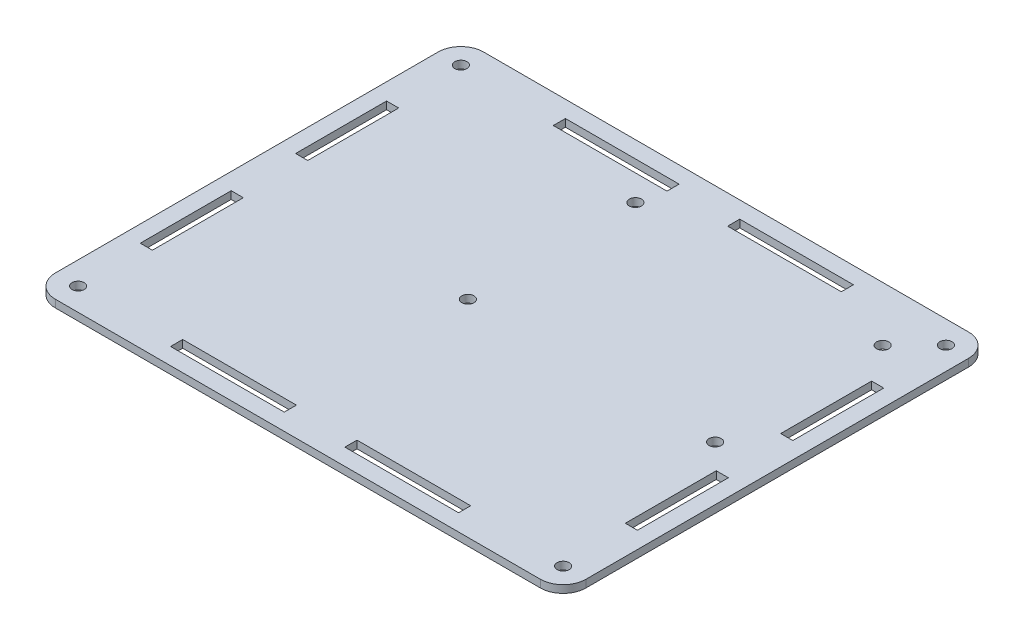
SolidWorks part; units mm, degrees
ref_plane "Front Plane" through (0, 0, 0) normal (0, 0, 1) x (1, 0, 0)
ref_plane "Top Plane" through (0, 0, 0) normal (0, 1, 0) x (1, 0, 0)
ref_plane "Right Plane" through (0, 0, 0) normal (1, 0, 0) x (0, 0, -1)
sketch "Sketch1" plane through (0, 0, 0) normal (0, 1, 0) x (1, 0, 0)
  line L0 (0, 0) -> (0, 50000) construction
  line L1 (0, 0) -> (140, 0)
  line L2 (0, 0) -> (0, 113)
  line L3 (0, 113) -> (140, 113)
  line L4 (140, 0) -> (140, 113)
  line L9 (140, 0) -> (140, 50000) construction
  line L10 (128, 0) -> (128, 50000) construction
  line L11 (66.2458, -26.4225) -> (66.2458, 49973.5775) construction
  line L12 (52.3371, 157.6359) -> (52.3371, -49842.3641) construction
  line L13 (12, -41.4903) -> (12, 49958.5097) construction
  line L14 (-38.7648, 12) -> (49961.2352, 12) construction
  line L15 (-49.8918, 101) -> (49950.1082, 101) construction
  line L16 (135.6, 24) -> (132.4, 24)
  line L17 (-84.1999, 52) -> (49915.8001, 52) construction
  line L18 (70, 148.2273) -> (70, -49851.7727) construction
  line L19 (32, 7.6) -> (62, 7.6)
  line L20 (32, 108.6) -> (62, 108.6)
  line L21 (32, 108.6) -> (32, 105.4)
  line L22 (32, 105.4) -> (62, 105.4)
  line L23 (62, 108.6) -> (62, 105.4)
  line L28 (32, 7.6) -> (32, 4.4)
  line L29 (32, 4.4) -> (62, 4.4)
  line L30 (62, 7.6) -> (62, 4.4)
  line L35 (108, 7.6) -> (108, 4.4)
  line L40 (4.4, 89) -> (7.6, 89)
  line L41 (4.4, 89) -> (4.4, 65)
  line L42 (4.4, 65) -> (7.6, 65)
  line L43 (7.6, 89) -> (7.6, 65)
  line L44 (4.4, 48) -> (7.6, 48)
  line L45 (4.4, 48) -> (4.4, 24)
  line L46 (4.4, 24) -> (7.6, 24)
  line L47 (7.6, 48) -> (7.6, 24)
  line L56 (108, 4.4) -> (78, 4.4)
  line L57 (78, 7.6) -> (78, 4.4)
  line L58 (108, 7.6) -> (78, 7.6)
  line L59 (108, 105.4) -> (78, 105.4)
  line L60 (78, 108.6) -> (78, 105.4)
  line L61 (108, 108.6) -> (78, 108.6)
  line L62 (108, 108.6) -> (108, 105.4)
  line L63 (132.4, 48) -> (132.4, 24)
  line L64 (135.6, 48) -> (132.4, 48)
  line L65 (135.6, 48) -> (135.6, 24)
  line L66 (135.6, 65) -> (132.4, 65)
  line L67 (132.4, 89) -> (132.4, 65)
  line L68 (135.6, 89) -> (132.4, 89)
  line L69 (135.6, 89) -> (135.6, 65)
  line L70 (-70.1779, 42) -> (49929.8221, 42) construction
  circle A1 centre (60.437, 98.62) radius 1.6
  circle A2 centre (125.69, 98.62) radius 1.6
  circle A3 centre (125.69, 54.418) radius 1.6
  circle A4 centre (60.437, 54.418) radius 1.6
  circle A7 centre (6, 107) radius 1.6
  circle A8 centre (134, 107) radius 1.6
  circle A9 centre (134, 6) radius 1.6
  circle A10 centre (6, 6) radius 1.6
  point P75 (0, 0)
  point P76 (0, 0)
  point P77 (0, 0)
  point P78 (32, 107)
  point P79 (0, 0)
  point P88 (32, 6)
  point P95 (6, 89)
  point P96 (6, 65)
  point P97 (6, 48)
  point P98 (6, 24)
  dimension "D14" = 65.253
  dimension "D16" = 8
  dimension "D22" = 30
  dimension "D24" = 44.202
  dimension "D1" = 113
  dimension "D2" = 140
  dimension "D5" = 2.31
  dimension "D6" = 12
  dimension "D7" = 12
  dimension "D8" = 12
  dimension "D9" = 12
  dimension "D10" = 6
  dimension "D11" = 6
  dimension "D12" = 6
  dimension "D13" = 6
  dimension "D15" = 70
  dimension "D17" = 8
  dimension "D18" = 12
  dimension "D19" = 12
  dimension "D20" = 17
  dimension "D21" = 2.38
  dimension "D23" = 49
  dimension "D30" = 30
  dimension "D38" = 30
  dimension "D40" = 24
  dimension "D43" = 24
  dimension "D48" = 3.2
extrude "Boss-Extrude1" add sketch "Sketch1" along normal blind 2
fillet "Fillet1" radius 6 1 edges at (0, 1, -113)
fillet "Fillet2" radius 6 1 edges at (0, 1, 0)
fillet "Fillet3" radius 6 2 edges at (140, 1, -113) (140, 1, 0)
